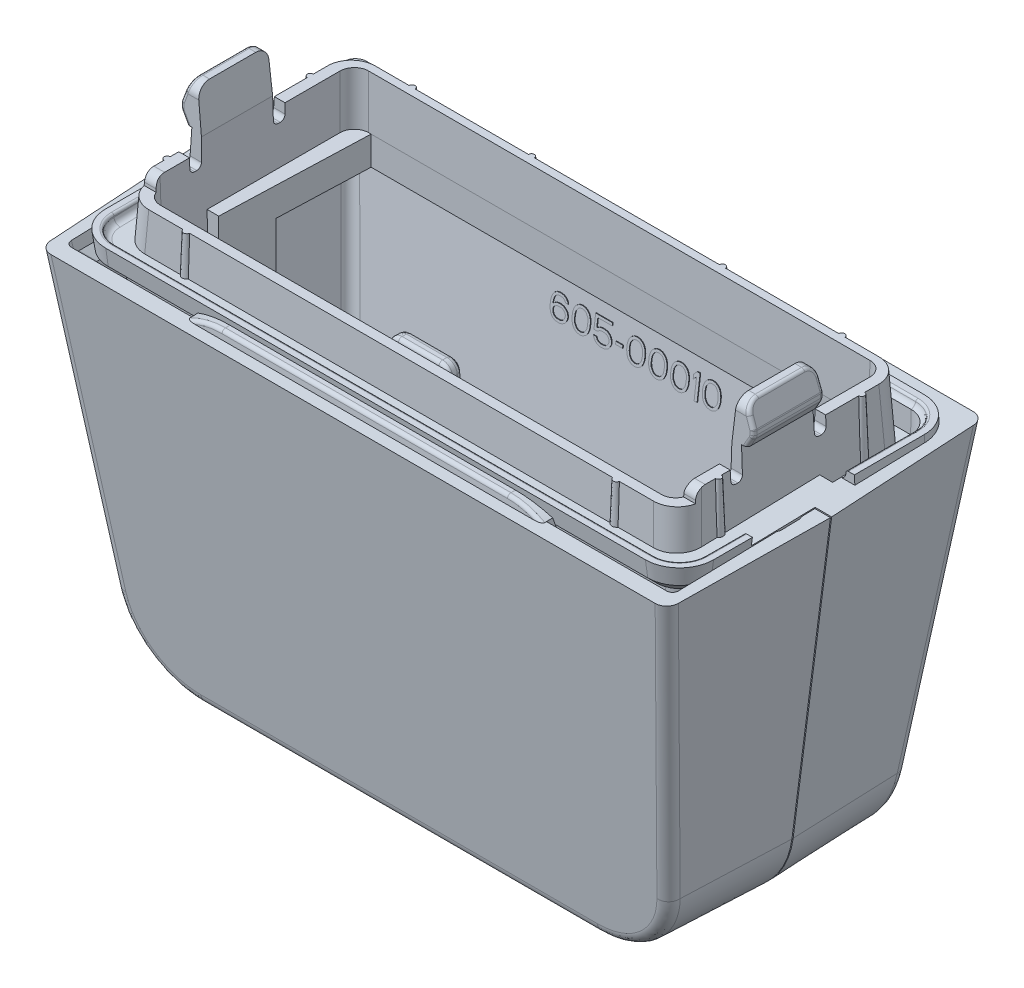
SolidWorks part; units mm, degrees
ref_plane "前基準面" through (0, 0, 0) normal (0, 0, 1) x (1, 0, 0)
ref_plane "上基準面" through (0, 0, 0) normal (0, 1, 0) x (1, 0, 0)
ref_plane "右基準面" through (0, 0, 0) normal (1, 0, 0) x (0, 0, -1)
imported_body "輸入1"
imported_body "輸入2"
other "移動面1" parameters "D1"=1.2
